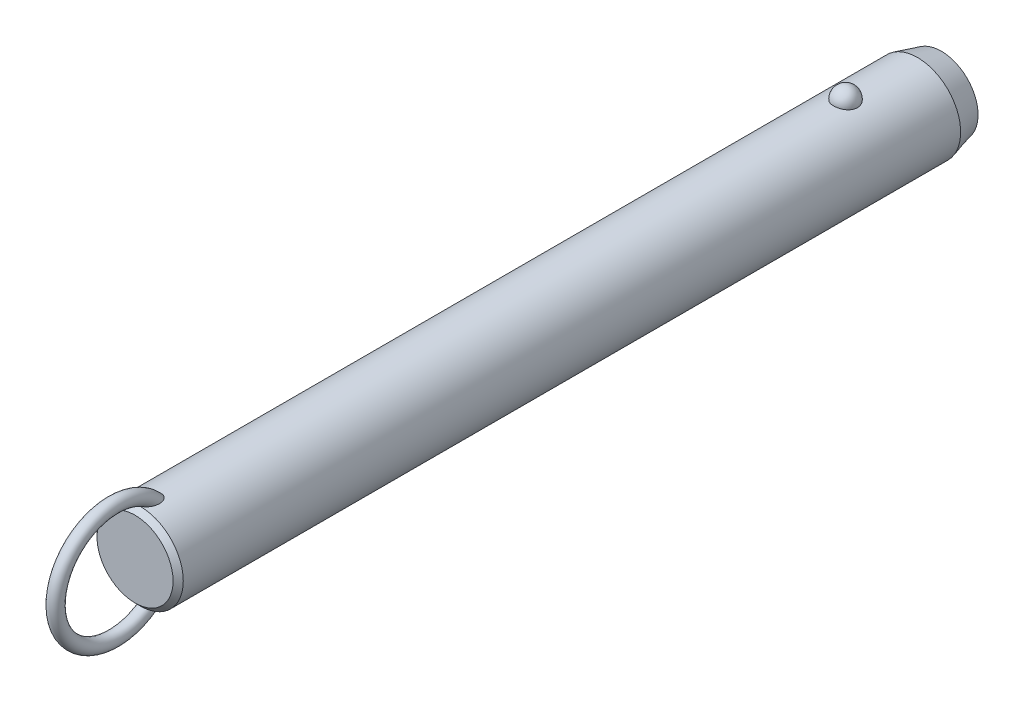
SolidWorks part; units mm, degrees
ref_plane "Front Plane" through (0, 0, 0) normal (0, 0, 1) x (1, 0, 0)
ref_plane "Top Plane" through (0, 0, 0) normal (0, 1, 0) x (1, 0, 0)
ref_plane "Right Plane" through (0, 0, 0) normal (1, 0, 0) x (0, 0, -1)
sketch "Sketch2" plane through (0, 0, 0) normal (0, 0, 1) x (1, 0, 0)
  circle A0 centre (0, 0) radius 12.7
  point P3 (0, 12.7)
  dimension "D1" = 25.4
extrude "Boss-Extrude1" add sketch "Sketch2" along normal blind 193
sketch "Sketch3" plane through (0, 0, 0) normal (0, 0, -1) x (-1, 0, 0)
  circle A0 centre (0, 0) radius 12.7
  dimension "D1" = 25.4
extrude "Boss-Extrude2" add sketch "Sketch3" along normal blind 31.7
chamfer "Chamfer1" distance 7 angle 15 1 edges at (-12.7, 0, -31.7)
sketch "Sketch12" plane through (0, 0, 0) normal (1, 0, 0) x (0, 0, -1)
  line L0 (-193, 12.7) -> (-193, -12.7) construction
  point P0 (-193, 0)
sketch "Sketch13" plane through (0, 0, 0) normal (1, 0, 0) x (0, 0, -1)
  circle A0 centre (-212.05, 0) radius 19.05
  point P2 (-193, 0)
  dimension "D1" = 38.1
sketch "Sketch14" plane through (0, 0, 0) normal (0, 1, 0) x (1, 0, 0)
  circle A0 centre (0, -195) radius 2
  point P2 (0, -193)
  dimension "D1" = 4
sweep "Sweep1" add profiles "Sketch14" path "Sketch13"
sketch "Sketch15" plane through (0, 0, 193) normal (0, 0, 1) x (1, 0, 0)
  circle A0 centre (0, 0) radius 12.7
  dimension "D1" = 25.4
extrude "Boss-Extrude3" add sketch "Sketch15" along normal blind 12.7
chamfer "Chamfer2" distance 1.5 angle 45 1 edges at (12.7, 0, 205.7)
sketch "Sketch18" plane through (0, 0, 0) normal (1, 0, 0) x (0, 0, -1)
  line L0 (24.7, 12.7) -> (-197.851, 12.7) construction
  line L1 (3.5, 16.2) -> (3.5, 9.2)
  line L2 (-197.851, -12.7) -> (24.7, -12.7) construction
  arc A0 (3.5, 16.2) -> (3.5, 9.2) centre (3.5, 12.7) ccw
  point P4 (0, 12.7)
  dimension "D1" = 28.9
revolve "Revolve1" add sketch "Sketch18" angle 360 about L1
